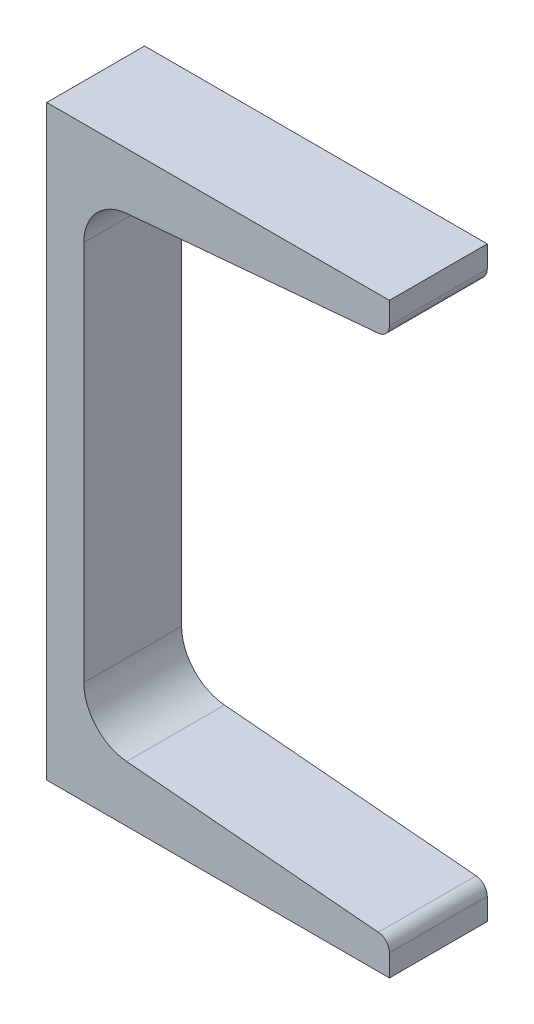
SolidWorks part; units mm, degrees
ref_plane "Plane1" through (0, 0, 0) normal (0, 0, 1) x (1, 0, 0)
ref_plane "Plane2" through (0, 0, 0) normal (0, 1, 0) x (-1, 0, 0)
ref_plane "Plane3" through (0, 0, 0) normal (1, 0, 0) x (0, 0, -1)
sketch "Sketch1" plane through (0, 0, 0) normal (0, 0, 1) x (1, 0, 0)
  line L0 (89.0016, 152.4) -> (0, 152.4)
  line L1 (89.0016, 0) -> (0, 0)
  line L2 (0, 152.4) -> (0, 0)
  line L3 (7.8492, 0) -> (-7.8492, 0) construction
  line L4 (0, -15.6984) -> (0, 15.6984) construction
  line L5 (0, 12.065) -> (89.0016, 12.065) construction
  line L6 (89.0016, 152.4) -> (89.0016, 143.8072)
  line L7 (89.0016, 0) -> (89.0016, 8.5928)
  line L12 (9.6266, 125.6909) -> (9.6266, 26.7091)
  line L17 (20.756, 137.8365) -> (89.0016, 143.8072)
  line L18 (20.756, 14.5635) -> (89.0016, 8.5928)
  arc A9 (9.6266, 26.7091) -> (20.756, 14.5635) centre (21.8186, 26.7091) ccw
  arc A10 (9.6266, 125.6909) -> (20.756, 137.8365) centre (21.8186, 125.6909) cw
  dimension "RI" = 12.192
  dimension "D2" = 5
  dimension "D3" = 26.7091
  dimension "Depth" = 152.4
  dimension "BF" = 89.0016
  dimension "TW" = 9.6266
  dimension "TF" = 12.065
  dimension "d1" = 98.9818
extrude "BaseMchannel" add sketch "Sketch1" along normal mid plane 25.4
fillet "ToeFillet" radius 3.175 2 edges at (89.0016, 8.5928, 0) (89.0016, 143.8072, 0)
equation "\"d1@Sketch1\" = \"Depth@Sketch1\" - 2*\"TF@Sketch1\" -  2*( \"RI@Sketch1\" * cos(\"D2@Sketch1\"/180*3.141592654))-2*((((\"BF@Sketch1\"-\"TW@Sketch1\")/2)-(\"RI@Sketch1\"-\"RI@Sketch1\"*sin(\"D2@Sketch1\"/180*3.141592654"
equation "\"D3@Sketch1\" =  ( \"Depth@Sketch1\" - \"d1@Sketch1\" )  / 2"
